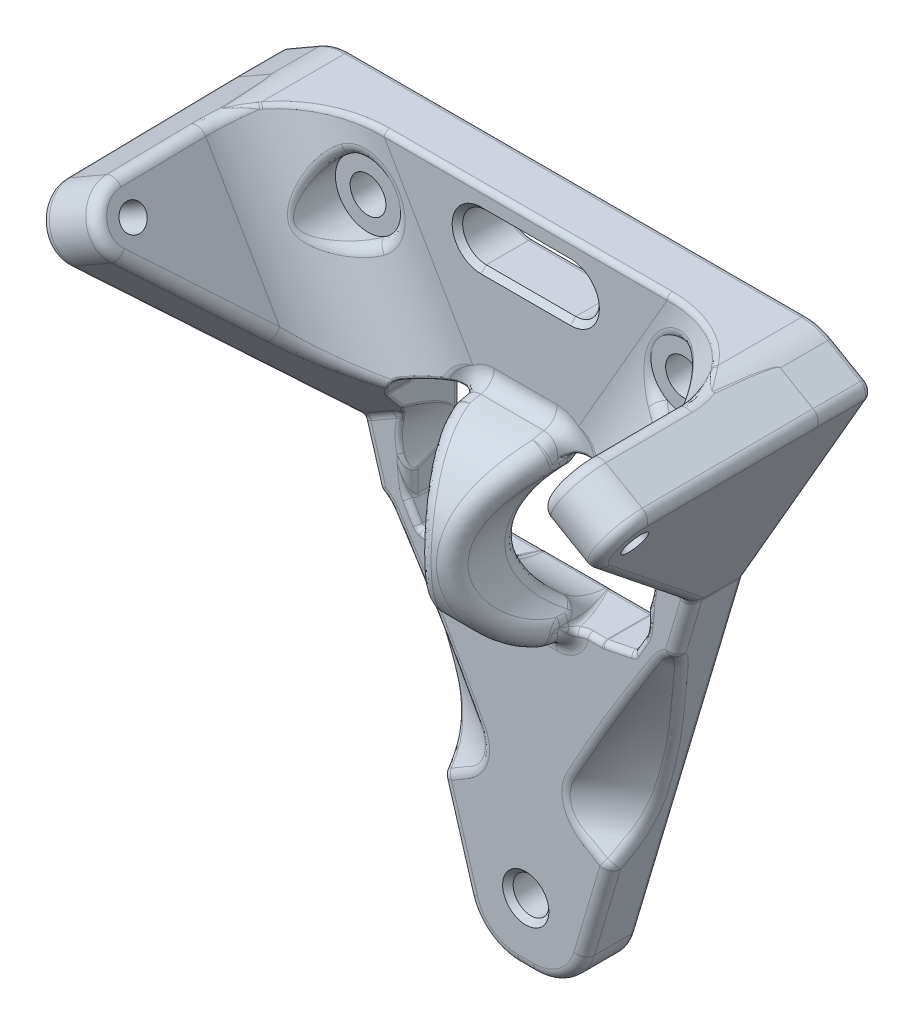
SolidWorks part; units mm, degrees
ref_plane "Płaszczyzna przednia" through (0, 0, 0) normal (0, 0, 1) x (1, 0, 0)
ref_plane "Płaszczyzna górna" through (0, 0, 0) normal (0, 1, 0) x (1, 0, 0)
ref_plane "Płaszczyzna prawa" through (0, 0, 0) normal (1, 0, 0) x (0, 0, -1)
sketch "Szkic1" plane through (0, 0, 0) normal (0, 0, 1) x (1, 0, 0)
  line L0 (-15, 50.4414) -> (15, 50.4414) construction
  line L1 (0, 0) -> (0, 50.4414) construction
  line L2 (-23.0439, 56.4414) -> (23.0439, 56.4414)
  line L3 (23.0439, 56.4414) -> (4.4754, -6)
  line L4 (4.4754, -6) -> (-4.4754, -6)
  line L5 (-4.4754, -6) -> (-23.0439, 56.4414)
  circle A0 centre (0, 0) radius 1.7
  circle A1 centre (15, 50.4414) radius 1.7
  circle A2 centre (-15, 50.4414) radius 1.7
  point P12 (0, 56.4414)
  point P13 (0, -6)
  dimension "D3" = 3.4
  dimension "D1" = 30
  dimension "D2" = 50.4414
  dimension "D4" = 6
  dimension "D5" = 6
  dimension "D6" = 6
  dimension "D7" = 6
extrude "Dodanie-wyciągnięcie1" add sketch "Szkic1" along normal blind 5
sketch "Szkic2" plane through (0, 0, 0) normal (0, 0, -1) x (-1, 0, 0)
  line L0 (-23.0439, 56.4414) -> (23.0439, 56.4414) construction
  line L2 (10, 31.9919) -> (-10, 31.9919) construction
  line L3 (-23.0439, 56.4414) -> (23.0439, 56.4414) construction
  circle A2 centre (10, 31.9919) radius 2.15
  circle A3 centre (-10, 31.9919) radius 2.15
  point P8 (0, 56.4414)
  point P9 (0, 31.9919)
  dimension "D3" = 4.3
  dimension "D1" = 24.4495
  dimension "D2" = 20
extrude "Wytnij-wyciągnięcie1" cut sketch "Szkic2" against normal through all
sketch "Szkic3" plane through (-2.0228, 1.1678, 0) normal (-0.866, 0.5, 0) x (0, 0, 1)
  line L0 (21.13, 60.1869) -> (5, 60.4016)
  line L1 (5, 60.4016) -> (5, 37.3577) construction
  line L2 (23.434, 54.6892) -> (5, 35.4414)
  line L3 (5, 37.3577) -> (5, -7.4339) construction
  line L4 (5, 35.4414) -> (5, 60.4016)
  circle A2 centre (21.0868, 56.9372) radius 1.2
  arc A3 (23.434, 54.6892) -> (21.13, 60.1869) centre (21.0868, 56.9372) ccw
  circle A6 centre (60.0368, 12.9372) radius 2.25
  arc A7 (57.2452, 11.273) -> (62.0774, 15.4667) centre (60.0368, 12.9372) ccw
  dimension "D1" = 2.4
  dimension "D2" = 47
sketch "Szkic4" plane through (2.0228, 1.1678, 0) normal (0.866, 0.5, 0) x (0, 0, -1)
  circle A5 centre (-21.0868, 56.9372) radius 2.25
  arc A6 (-18.6635, 54.7714) -> (-23.4859, 59.1296) centre (-21.0868, 56.9372) ccw
  circle A7 centre (-40.3368, 35.6372) radius 15.5
  circle A8 centre (-60.0368, 12.9372) radius 2.25
  arc A9 (-62.0774, 15.4667) -> (-57.2452, 11.273) centre (-60.0368, 12.9372) ccw
surface "Powierzchnia-Odsunięcie1" parameters "D1"=0.3
surface "Powierzchnia-Odsunięcie2" parameters "D1"=0.3
split "Podziel1" trimming surface bodies 107 bodies to split 103 resulting bodies 108 109
delete or keep bodies "Obiekt-Usuń/zachowaj 1" type delete bodies bodies 108
other "Przecięcie1"
extrude "Dodanie-wyciągnięcie3" add sketch "Szkic3" along normal blind 6 contours L2 A3 L0 L4 A2
sketch "Szkic10" plane through (0, 0, 5) normal (0, 0, -1) x (-1, 0, 0)
  line L4 (-15.773, 31.991) -> (-23.0439, 56.4414)
  line L5 (-23.0439, 56.4414) -> (-28.178, 53.4772)
  line L6 (-28.178, 53.4772) -> (-15.773, 31.991)
  line L8 (-15.773, 31.991) -> (-23.0439, 56.4414)
  line L9 (-23.0439, 56.4414) -> (-28.178, 53.4772)
  line L10 (-28.178, 53.4772) -> (-15.773, 31.991)
  dimension "D1" = 0
extrude "Dodanie-wyciągnięcie4" add sketch "Szkic10" along normal up to surface (5 mm away)
mirror "Lustro1" about plane through (0, 0, 0) normal (1, 0, 0) of "Dodanie-wyciągnięcie4", "Dodanie-wyciągnięcie3"
sketch "Szkic23" plane through (0, 0, 0) normal (0, 0, -1) x (-1, 0, 0)
  line L12 (10.213, 38.6681) -> (7.327, 39.2452)
  line L13 (11.2559, 36.8796) -> (10.213, 38.6681)
  line L14 (11.2559, 27.1042) -> (11.2559, 36.8796)
  line L15 (10.213, 25.3156) -> (11.2559, 27.1042)
  line L16 (7.3266, 24.7384) -> (10.213, 25.3156)
  line L17 (-7.3266, 24.7384) -> (7.3266, 24.7384)
  line L18 (-10.2131, 25.3156) -> (-7.3266, 24.7384)
  line L19 (-11.2559, 27.1042) -> (-10.2131, 25.3156)
  line L20 (-11.2559, 36.8796) -> (-11.2559, 27.1042)
  line L21 (-10.2131, 38.6681) -> (-11.2559, 36.8796)
  line L22 (-7.3266, 39.2453) -> (-10.2131, 38.6681)
  line L23 (7.327, 39.2452) -> (-7.3266, 39.2453)
extrude "Wytnij-wyciągnięcie8" cut sketch "Szkic23" against normal through all
sketch "Szkic24" plane through (0, 0, 5) normal (0, 0, 1) x (1, 0, 0)
  line L0 (-11.2559, 30.2468) -> (-11.2559, 33.7369)
  line L1 (11.2559, 33.7369) -> (11.2559, 30.2468)
  arc A0 (11.2559, 30.2468) -> (11.2559, 33.7369) centre (10, 31.9919) ccw construction
  arc A1 (-11.2559, 33.7369) -> (-11.2559, 30.2468) centre (-10, 31.9919) ccw construction
  arc A2 (11.2559, 30.2468) -> (11.2559, 33.7369) centre (10, 31.9919) ccw
  arc A3 (-11.2559, 33.7369) -> (-11.2559, 30.2468) centre (-10, 31.9919) ccw
extrude "Dodanie-wyciągnięcie5" add sketch "Szkic24" against normal up to surface (5 mm away)
sketch3d "Szkic 3D1"
  arc A0 (-1.296, 31.9919, 3.7106) -> (-10.9293, 31.9919, 1.9108) centre (-6.1127, 31.9919, 2.8107) ccw construction
  arc A1 (-10.9293, 31.9919, 1.9108) -> (-1.296, 31.9919, 3.7106) centre (-6.1127, 31.9919, 2.8107) ccw construction
  arc A2 (1.35, 31.9919, 3.8078) -> (10.9862, 31.9919, 2.0238) centre (6.1681, 31.9919, 2.9158) ccw construction
  arc A3 (10.9862, 31.9919, 2.0238) -> (1.35, 31.9919, 3.8078) centre (6.1681, 31.9919, 2.9158) ccw construction
  arc A4 (-1.296, 31.9919, 3.7106) -> (-10.9293, 31.9919, 1.9108) centre (-6.1127, 31.9919, 2.8107) ccw
  arc A5 (-10.9293, 31.9919, 1.9108) -> (-1.296, 31.9919, 3.7106) centre (-6.1127, 31.9919, 2.8107) ccw
  arc A6 (1.35, 31.9919, 3.8078) -> (10.9862, 31.9919, 2.0238) centre (6.1681, 31.9919, 2.9158) ccw
  arc A7 (10.9862, 31.9919, 2.0238) -> (1.35, 31.9919, 3.8078) centre (6.1681, 31.9919, 2.9158) ccw
  point P3 (-7.0126, 31.9919, 7.6274)
  point P5 (-7.0126, 31.9919, 7.6274)
  point P6 (-7.0126, 31.9919, 7.6274)
  point P7 (-7.0126, 31.9919, 7.6274)
  point P11 (5.2761, 31.9919, -1.9023)
  point P13 (5.2761, 31.9919, -1.9023)
  point P14 (5.2761, 31.9919, -1.9023)
  point P15 (5.2761, 31.9919, -1.9023)
ref_plane "Płaszczyzna1" through (-0.7136, 0, 3.8195) normal (-0.1837, 0, 0.983) x (0.983, 0, 0.1837)
sketch "Szkic25" plane through (-0.7136, 0, 3.8195) normal (-0.1837, 0, 0.983) x (0.983, 0, 0.1837)
  circle A0 centre (-5.4925, 31.9919) radius 5.5
  dimension "D1" = 11
extrude "Wytnij-wyciągnięcie9" cut sketch "Szkic25" along normal through all both and the other way through all
ref_plane "Płaszczyzna2" through (0.7263, 0, 3.9233) normal (0.182, 0, 0.9833) x (0.9833, 0, -0.182)
sketch "Szkic26" plane through (0.7263, 0, 3.9233) normal (0.182, 0, 0.9833) x (0.9833, 0, -0.182)
  circle A0 centre (5.5342, 31.9919) radius 5.5
  dimension "D1" = 11
extrude "Wytnij-wyciągnięcie10" cut sketch "Szkic26" along normal through all both and the other way through all
sketch "Szkic27" plane through (0, 0, 0) normal (0, 0, -1) x (-1, 0, 0)
  line L0 (-4.25, 49.7877) -> (4.25, 49.7877) construction
  line L1 (-4.25, 49.7877) -> (4.25, 49.7877)
  line L2 (4.25, 54.2877) -> (-4.25, 54.2877)
  arc A0 (4.25, 49.7877) -> (4.25, 54.2877) centre (4.25, 52.0377) ccw construction
  arc A1 (-4.25, 54.2877) -> (-4.25, 49.7877) centre (-4.25, 52.0377) ccw construction
  arc A2 (4.25, 49.7877) -> (4.25, 54.2877) centre (4.25, 52.0377) ccw
  arc A3 (-4.25, 54.2877) -> (-4.25, 49.7877) centre (-4.25, 52.0377) ccw
extrude "Wytnij-wyciągnięcie11" cut sketch "Szkic27" against normal through all
fillet "Zaokrąglenie1" radius 5 4 edges at (-4.4754, -6, 2.5) (-23.0439, 56.4414, 2.5) (23.0439, 56.4414, 2.5) (4.4754, -6, 2.5)
fillet "Zaokrąglenie2" radius 1 4 edges at (-15.773, 31.991, 2.5) (15.773, 31.991, 2.5) (28.178, 53.4772, 2.5) (-28.178, 53.4772, 2.5)
fillet "Zaokrąglenie5" radius 1 6 edges at (-23.5612, 56.0837, 8.8381) (-25.7581, 54.8743, 5) (-27.5682, 53.7655, 9.147) (-27.7838, 53.3469, 21.8689) (-26.5245, 50.6132, 24.333) (-20.5099, 40.1956, 14.217)
fillet "Zaokrąglenie6" radius 1 7 edges at (23.5612, 56.0837, 8.8381) (25.7581, 54.8743, 5) (27.5682, 53.7655, 9.147) (27.808, 53.0214, 22.5838) (26.5245, 50.6132, 24.333) (-15.1358, 29.8483, 5) (20.5099, 40.1956, 14.217)
fillet "Zaokrąglenie7" radius 1 3 edges at (15.3598, 32.2784, 5) (15.1358, 29.8483, 5) (11.2369, 16.7373, 2.1232)
fillet "Zaokrąglenie9" radius 1 2 edges at (11.2559, 28.0586, 5) (-11.2559, 28.0823, 5)
sketch "Szkic29" plane through (0, 0, 5) normal (0, 0, 1) x (1, 0, 0)
  line L1 (-4.5, 39.4452) -> (4.5, 39.4453)
  line L2 (-4.5, 39.4452) -> (-4.5, 24.5384)
  line L3 (-4.5, 24.5384) -> (4.5, 24.5384)
  line L4 (4.5, 39.4453) -> (4.5, 24.5384)
  line L6 (7.3266, 24.7384) -> (-7.3266, 24.7384) construction
  line L8 (-7.327, 39.2452) -> (7.3266, 39.2453) construction
  line L9 (0, 0) -> (0, 24.5384) construction
  dimension "D1" = 0.2
  dimension "D2" = 0.2
  dimension "D3" = 9
extrude "Dodanie-wyciągnięcie8" add sketch "Szkic29" against normal blind 1
sketch "Szkic30" plane through (-4.5, 0, 0) normal (-1, 0, 0) x (0, 0, 1)
  line L0 (5, 39.2452) -> (5, 24.7384) construction
  line L1 (5, 40.7418) -> (5, 23.2418)
  arc A0 (5, 23.2418) -> (5, 40.7418) centre (5, 31.9918) ccw
  dimension "D1" = 17.5
extrude "Dodanie-wyciągnięcie9" add sketch "Szkic30" against normal up to surface (9 mm away)
ref_plane "Płaszczyzna4" through (0, 0, 13.75) normal (0, 0, 1) x (1, 0, 0)
sketch "Szkic42" plane through (0, 0, 13.75) normal (0, 0, 1) x (1, 0, 0)
  line L0 (0, 40.7418) -> (0, 23.2418) construction
  line L1 (4.5, 40.7418) -> (-4.5, 40.7418) construction
  line L2 (4.5, 23.2418) -> (-4.5, 23.2418) construction
  line L3 (30.0605, 31.9918) -> (-30.0605, 31.9918) construction
  line L4 (4.5, 23.2418) -> (4.5, 40.7418) construction
  line L5 (-4.5, 40.7418) -> (-4.5, 23.2418) construction
  line L6 (4.5, 25.623) -> (4.5, 38.3607)
  line L7 (-4.5, 38.3607) -> (-4.5, 25.623)
  arc A1 (-4.5, 25.623) -> (-4.5, 38.3607) centre (-10.5, 31.9918) ccw
  arc A2 (4.5, 25.623) -> (4.5, 38.3607) centre (10.5, 31.9918) cw
  point P8 (0, 31.9918)
  point P9 (0, 31.9918)
  dimension "D1" = 3.5
  dimension "D2" = 17.5
extrude "Wytnij-wyciągnięcie23" cut sketch "Szkic42" against normal through all
sketch "Szkic44" plane through (0, 0, 4) normal (0, 0, -1) x (-1, 0, 0)
  line L6 (4.5, 24.7384) -> (4.5, 25.623)
  line L7 (4.5, 38.3607) -> (4.5, 39.2452)
  line L8 (4.5, 39.2452) -> (-4.5, 39.2453)
  line L9 (-4.5, 39.2453) -> (-4.5, 38.3607)
  line L10 (-4.5, 25.623) -> (-4.5, 24.7384)
  line L11 (-4.5, 24.7384) -> (4.5, 24.7384)
  line L12 (4.5, 24.7384) -> (4.5, 25.623)
  line L13 (4.5, 38.3607) -> (4.5, 39.2452)
  line L14 (4.5, 39.2452) -> (-4.5, 39.2453)
  line L15 (-4.5, 39.2453) -> (-4.5, 38.3607)
  line L16 (-4.5, 25.623) -> (-4.5, 24.7384)
  line L17 (-4.5, 24.7384) -> (4.5, 24.7384)
  arc A2 (4.5, 38.3607) -> (4.5, 25.623) centre (10.5, 31.9918) ccw
  arc A3 (-4.5, 25.623) -> (-4.5, 38.3607) centre (-10.5, 31.9918) ccw
  arc A4 (4.5, 38.3607) -> (4.5, 25.623) centre (10.5, 31.9918) ccw
  arc A5 (-4.5, 25.623) -> (-4.5, 38.3607) centre (-10.5, 31.9918) ccw
  dimension "D1" = 0
extrude "Dodanie-wyciągnięcie12" add sketch "Szkic44" along normal up to surface (4 mm away)
sketch "Szkic45" plane through (-4.5, 0, 0) normal (-1, 0, 0) x (0, 0, 1)
  line L0 (13.75, 31.9918) -> (0, 31.9918) construction
  line L1 (0, 31.8781) -> (0, -2.4252) construction
  circle A0 centre (0, 31.9918) radius 7.2534
  arc A1 (11, 25.623) -> (11, 38.3607) centre (5, 31.9918) ccw construction
extrude "Wytnij-wyciągnięcie24" cut sketch "Szkic45" against normal up to surface (9 mm away)
fillet "Zaokrąglenie15" radius 1 4 edges at (-4.5, 38.3607, 7.2356) (-4.5, 25.623, 7.2356) (4.5, 25.623, 7.2356) (4.5, 38.3607, 7.2356)
fillet "Zaokrąglenie16" radius 1.5 20 edges at (-4.5, 39.1277, 1.3007) (-4.4289, 38.4084, 3.3823) (-4.5, 24.856, 1.3007) (-4.322, 25.7744, 3.7357) (4.5, 24.856, 1.3007) (4.4289, 25.5753, 3.3823) (4.5, 39.1277, 1.3007) (4.322, 38.2093, 3.7357) (4.5, 40.2365, 7.9306) (4.4281, 38.4065, 10.951) (-4.5, 23.7472, 7.9306) (4.5, 23.7472, 7.9306) (-4.5, 40.2365, 7.9306) (4.3831, 25.674, 11.0537) (-4.4281, 25.5772, 10.951) (-1.75, 31.9918, 13.75) (-4.3831, 38.3097, 11.0537) (-1.7933, 32.8614, 7.2011) (1.7933, 31.1223, 7.2011) (1.75, 31.9918, 13.75)
fillet "Zaokrąglenie17" radius 1.5 6 edges at (4.0595, 23.68, 5) (0, 23.2418, 5) (-4.0595, 23.68, 5) (0, 40.7418, 5) (4.0594, 40.3037, 5) (-4.0595, 40.3037, 5)
fillet "Zaokrąglenie18" radius 0.5 21 edges at (11.5488, 27.6065, 4.7071) (4.5, 24.7384, 5.6233) (-4.5, 24.7384, 5.6233) (-11.5488, 27.6065, 4.7071) (-4.5, 39.2452, 5.6233) (11.2559, 27.1042, 2) (10.2131, 25.3156, 2.5) (7.3266, 24.7384, 2.5) (4.1333, 24.7384, 2.788) (-4.1333, 24.7384, 2.788) (-7.3266, 24.7384, 2.5) (-10.213, 25.3156, 2.5) (-11.2559, 27.1042, 2) (-11.2559, 36.8796, 2.5) (-10.213, 38.6681, 2.5) (3.6118, 39.2453, 1.3815) (-4.1333, 39.2452, 2.788) (-7.327, 39.2452, 2.5) (11.2559, 36.8796, 2.5) (10.2131, 38.6681, 2.5) (7.3266, 39.2453, 2.5)
fillet "Zaokrąglenie20" radius 1 6 edges at (-9.6762, 11.4891, 1.8839) (-13.8419, 26.7158, 4.7576) (9.6428, 11.3767, 1.8945) (13.7548, 26.7547, 4.8298) (-3.8386, 11.1046, 5) (3.9587, 11.5301, 5)
fillet "Zaokrąglenie21" radius 0.4 2 edges at (11.2559, 32.2644, 0.2217) (11.5447, 29.6183, 4.703)
fillet "Zaokrąglenie22" radius 0.4 2 edges at (-11.2559, 32.2642, 0.4285) (-11.6874, 29.9588, 4.8227)
fillet "Zaokrąglenie23" radius 1 11 edges at (-6.6631, 1.3567, 5) (-7.8102, 5.2235, 5) (3.4436, 10.6623, 5) (7.8461, 5.6428, 5) (-9.5965, 11.221, 1.2591) (7.7592, 6.107, 4.9528) (-7.7561, 6.1175, 4.9504) (6.6631, 1.3567, 5) (0, -6, 5) (-3.7354, -5.0079, 5) (3.7354, -5.0079, 5)
fillet "Zaokrąglenie24" radius 1 15 edges at (-11.8036, 33.9277, 4.8493) (-12.1276, 33.9124, 4.9917) (-15.784, 32.0281, 3.9805) (-15.4718, 32.1153, 4.737) (-13.5439, 33.1046, 5) (-14.8353, 32.3591, 5) (11.8668, 33.9386, 4.8886) (12.1617, 33.8973, 4.9956) (15.784, 32.0281, 3.9805) (15.6051, 32.0923, 4.5862) (14.8353, 32.3591, 5) (-12.2559, 33.6624, 5) (13.5439, 33.1046, 5)
fillet "Zaokrąglenie33" radius 0.5 20 edges at (-4.5137, 25.1208, 6.209) (-5.4977, 24.7384, 5.0849) (-6.6365, 24.7384, 5) (-7.3264, 24.7409, 5) (-10.9481, 26.5763, 5) (-11.8958, 28.4294, 5) (-10.185, 25.3549, 5) (-8.6838, 25.0098, 5) (11.7892, 28.1188, 5) (4.5137, 25.1208, 6.209) (5.3315, 24.7384, 5.1546) (7.3264, 24.7409, 5) (6.6365, 24.7384, 5) (8.6838, 25.0098, 5) (10.185, 25.3549, 5) (10.9481, 26.5763, 5)
fillet "Zaokrąglenie38" radius 8 4 edges at (-11.2559, 36.1671, 5.7222) (-17.0681, 46.2341, 5) (11.2559, 36.4558, 5) (17.0681, 46.2341, 5)
fillet "Zaokrąglenie39" radius 1 2 edges at (-6.7411, 40.1225, 5.2839) (6.7411, 40.1226, 5.2839)
fillet "Zaokrąglenie40" radius 1 6 edges at (21.8313, 54.4843, 24.1215) (17.402, 46.8126, 18.217) (-21.8313, 54.4843, 24.1215) (-17.402, 46.8126, 18.217) (12.8347, 39.8643, 10.2669) (-12.8347, 39.8643, 10.2669)
fillet "Zaokrąglenie41" radius 0.25 22 edges at (11.5391, 34.5779, 5.2619) (11.263, 32.2336, 0.2519) (11.2559, 36.0228, 6.3247) (11.3021, 35.0591, 5.5476) (11.8234, 34.1664, 5.0568) (11.7644, 33.9248, 4.8583) (11.2386, 36.8749, 7.0231) (10.9197, 37.4562, 7.3526) (6.3072, 39.2453, 5.0326) (6.6832, 39.9445, 5.2182) (8.7546, 38.9598, 6.3435) (13.0267, 40.4954, 9.8868) (10.5174, 38.1462, 7.6794) (10.2311, 38.5916, 7.5489) (3.4938, 39.2453, 0.9163) (4.6346, 39.2453, 5.8632)
fillet "Zaokrąglenie42" radius 0.25 17 edges at (-4.5137, 38.8629, 6.209) (-5.8161, 39.2452, 5.0108) (-11.8045, 33.6834, 4.7795) (-11.5149, 34.5564, 5.2324) (-11.2775, 35.0734, 5.5476) (-11.2559, 35.9948, 6.3015) (-11.2386, 36.8749, 7.0232) (-10.9197, 37.4562, 7.3526) (-10.4689, 38.2292, 7.683) (-10.1667, 38.6412, 7.4871) (-8.7546, 38.9597, 6.3435)
sketch "Szkic48" plane through (0, 0, 5) normal (0, 0, 1) x (1, 0, 0)
  circle A0 centre (-15, 50.4414) radius 3.1
  circle A1 centre (15, 50.4414) radius 3.1
  dimension "D1" = 6.2
extrude "Wytnij-wyciągnięcie27" cut sketch "Szkic48" along normal blind 21.5
fillet "Zaokrąglenie43" radius 1 2 edges at (18.042, 49.8446, 9.197) (-11.9104, 50.1871, 5.153)
chamfer "Sfazowanie1" distance 0.5 angle 45 5 edges at (1.7, 0, 5) (0, 54.2877, 5) (6.5, 52.0377, 5) (0, 49.7877, 5) (-6.5, 52.0377, 5)
fillet "Zaokrąglenie44" radius 0.5 53 edges at (-13.3, 50.4414, 0) (1.7, 0, 0) (22.9983, 56.271, 0) (0, 56.4414, 0) (-22.9983, 56.271, 0) (-25.7581, 54.8743, 0) (-27.7779, 53.37, 0) (-21.755, 42.3521, 0) (-15.7794, 31.9883, 0) (-10.639, 14.7264, 0) (-3.7354, -5.0079, 0) (0, -6, 0) (3.7354, -5.0079, 0) (10.639, 14.7264, 0) (15.7794, 31.9883, 0) (21.755, 42.3521, 0) (27.7779, 53.37, 0) (25.7581, 54.8743, 0) (16.7, 50.4414, 0) (0, 54.2877, 0) (6.5, 52.0377, 0) (0, 49.7877, 0) (-6.5, 52.0377, 0) (7.3264, 39.2429, 0) (8.6838, 38.9739, 0) (10.185, 38.6288, 0) (10.7571, 37.735, 0) (11.2386, 36.8749, 0) (11.2559, 31.9919, 0) (11.2386, 27.1089, 0) (10.7571, 26.2487, 0) (10.185, 25.3549, 0) (8.6838, 25.0098, 0) (7.3264, 24.7409, 0) (5.1385, 24.7384, 0) (0, 24.7384, 0) (-5.1386, 24.7384, 0) (-7.3264, 24.7409, 0) (-8.6838, 25.0098, 0) (-10.185, 25.3549, 0) (-10.7571, 26.2487, 0) (-11.2386, 27.1089, 0) (-11.2559, 31.9919, 0) (-11.2386, 36.8749, 0) (-10.7571, 37.735, 0) (-10.185, 38.6288, 0) (-8.684, 38.9739, 0) (-7.3267, 39.2428, 0) (-5.1387, 39.2452, 0) (0, 39.2452, 0) (3.0046, 39.2452, 0) (3.0108, 39.2453, 0) (5.1447, 39.2453, 0)
fillet "Zaokrąglenie45" radius 0.5 9 edges at (-23.2365, 56.2008, 10.5127) (-17.7557, 56.4414, 5.8023) (0, 56.4414, 5) (23.2365, 56.2008, 10.5127) (17.7557, 56.4414, 5.8023)
